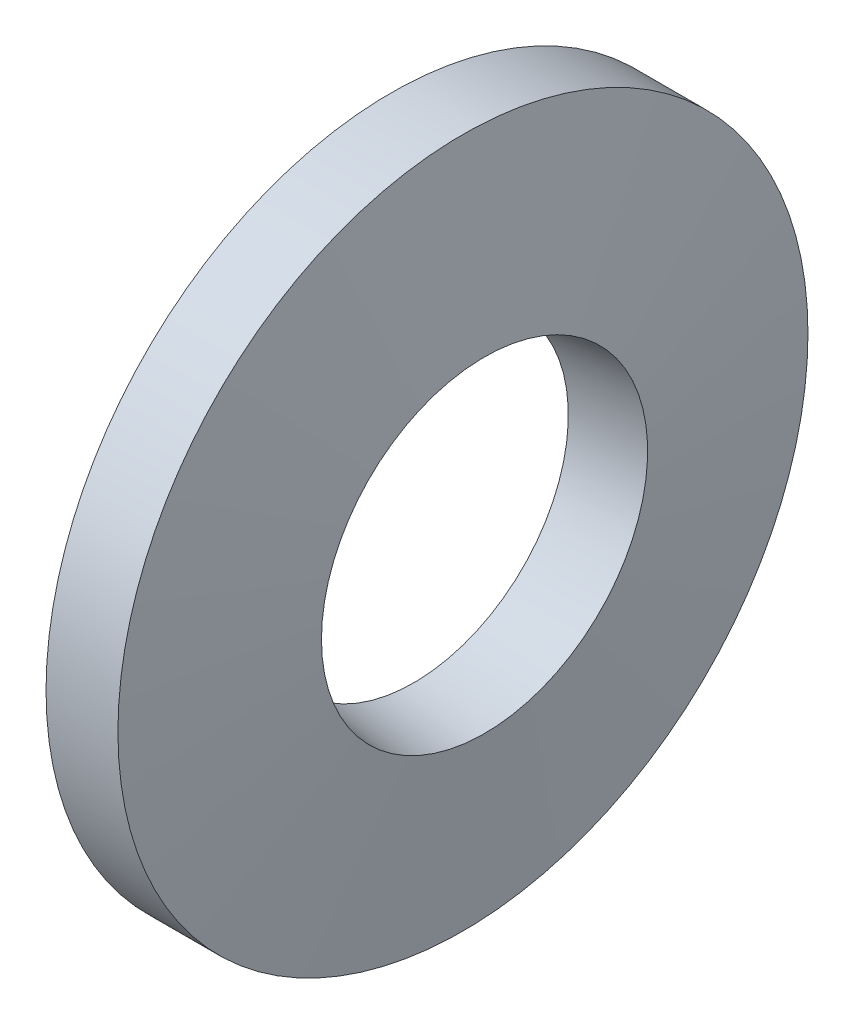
SolidWorks part; units mm, degrees
ref_plane "Ebene vorne" through (0, 0, 0) normal (0, 0, 1) x (1, 0, 0)
ref_plane "Ebene oben" through (0, 0, 0) normal (0, 1, 0) x (1, 0, 0)
ref_plane "Ebene rechts" through (0, 0, 0) normal (1, 0, 0) x (0, 0, -1)
ref_plane "Ebene1" through (0, 0, 0) normal (0, 0, 1) x (1, 0, 0)
sketch "Skizze1" plane through (0, 0, 0) normal (0, 0, 1) x (1, 0, 0)
  line L0 (0, 14.5) -> (0.95, 6.5)
  line L1 (0.95, 6.5) -> (3.9291, 6.8538)
  line L2 (3.9291, 6.8538) -> (3.0211, 14.5)
  line L3 (3.0211, 14.5) -> (0, 14.5)
  line L4 (50, 0) -> (-50, 0) construction
revolve "Rotation1" add sketch "Skizze1" angle 360 about L4
